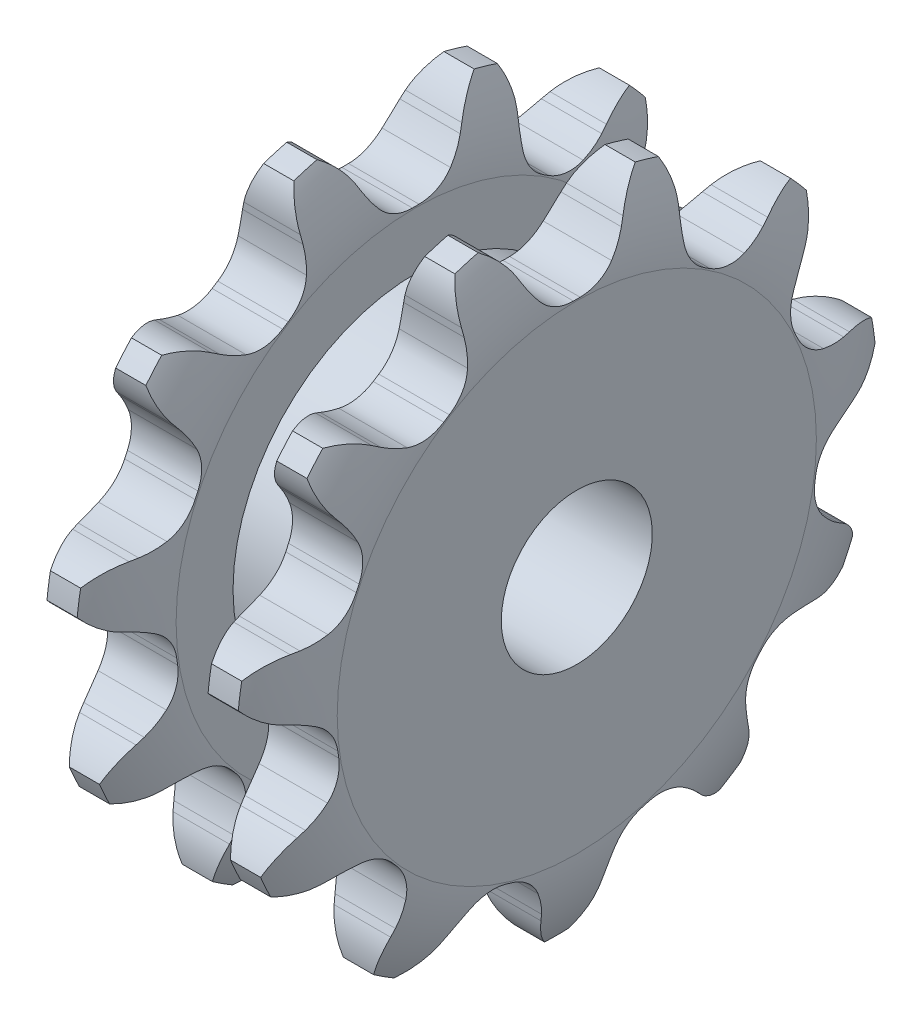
SolidWorks part; units mm, degrees
ref_plane "Plane1" through (0, 0, 0) normal (0, 0, 1) x (1, 0, 0)
ref_plane "Plane2" through (0, 0, 0) normal (0, 1, 0) x (1, 0, 0)
ref_plane "Plane3" through (0, 0, 0) normal (1, 0, 0) x (0, 0, -1)
other "Configuration Table"
sketch "Clipboard" plane through (0, 0, 0) normal (0, 1, 0) x (1, 0, 0)
  line L0 (0, 0) -> (6.2333, -1.2116)
  line L1 (-15, 0) -> (100, 0) construction
  line L2 (0, 0) -> (-0.5301, 0.5991)
  line L3 (0, 0) -> (-2.9891, 1.1425)
  line L4 (0, 0) -> (3.043, 0.5915)
  line L5 (0, 0) -> (-89.0105, -33.1983)
  line L6 (0, 0) -> (-7.6265, -5.1456)
  line L7 (-0.5301, 0.5991) -> (92.0355, 21.9696)
  line L8 (-76.2, 38.1) -> (-75.2, 38.1)
  line L9 (-73.2358, 39.4872) -> (-73.0836, 39.4947)
  line L10 (-73.0533, 76.1892) -> (-66.6533, 76.1892)
  circle A0 centre (0, 0) radius 1.651
  circle A1 centre (0, 0) radius 4
  circle A2 centre (0, 0) radius 4
sketch "BasProSke" plane through (0, 0, 0) normal (0, 1, 0) x (1, 0, 0)
  line L0 (-10, 0) -> (60, 0) construction
  line L1 (0, 0) -> (0, 9.5181)
  line L2 (0, 0) -> (9.2, 0)
  line L3 (9.2, 0) -> (9.2, 9.5181)
  line L4 (8.4, 12.7181) -> (0.8, 12.7181)
  arc A0 (0, 9.5181) -> (0.8, 12.7181) centre (6.8, 9.5181) cw
  arc A1 (9.2, 9.5181) -> (8.4, 12.7181) centre (2.4, 9.5181) ccw
revolve "Base-Revolve" add sketch "BasProSke" angle 360 about L0
sketch "GrvSke" plane through (0, 0, 0) normal (0, 1, 0) x (1, 0, 0)
  line L0 (2.8, 9.5181) -> (2.8, 7.2571)
  line L1 (2.8, 7.2571) -> (6.4, 7.2571)
  line L2 (6.4, 7.2571) -> (6.4, 9.5181)
  line L3 (2, 12.7181) -> (7.2, 12.7181)
  line L4 (4.6, 0) -> (4.6, 52.07) construction
  line L5 (-10, 0) -> (60, 0) construction
  line L6 (0, 0) -> (35.56, 0) construction
  arc A0 (6.4, 9.5181) -> (7.2, 12.7181) centre (13.2, 9.5181) cw
  arc A1 (2.8, 9.5181) -> (2, 12.7181) centre (-4, 9.5181) ccw
revolve "Groove" cut sketch "GrvSke" angle 360 about L6
pattern_linear "Grooves" [suppressed]
sketch "TooCutSke" plane through (0, 0, 0) normal (1, 0, 0) x (0, 0, -1)
  line L0 (1.9692, 10.9762) -> (2.1109, 11.2478)
  line L1 (0, 0) -> (0, 107) construction
  line L2 (0.2483, 11.2688) -> (-2.0258, 11.2688) construction
  line L4 (0.1322, 12.3974) -> (0.1322, 8.6148) construction
  line L5 (0.1322, 9.5714) -> (-0.1322, 9.5714)
  line L6 (-1.9692, 10.9762) -> (-2.1109, 11.2478)
  arc A0 (1.4237, 10.1675) -> (1.9692, 10.9762) centre (-1.8779, 12.9828) ccw
  arc A1 (1.4237, 10.1675) -> (0.1322, 9.5714) centre (0.1322, 11.2688) cw
  arc A2 (2.1109, 11.2478) -> (4.5677, 12.7373) centre (4.5677, 9.9664) cw
  arc A3 (-0.1322, 9.5714) -> (-1.4237, 10.1675) centre (-0.1322, 11.2688) cw
  arc A4 (-1.4237, 10.1675) -> (-1.9692, 10.9762) centre (1.8779, 12.9828) cw
  arc A5 (-2.1109, 11.2478) -> (-4.5677, 12.7373) centre (-4.5677, 9.9664) ccw
  arc A6 (4.5677, 12.7373) -> (-4.5677, 12.7373) centre (0, 0) ccw
extrude "ToothCut" cut sketch "TooCutSke" along normal through all
pattern_circular "TeethCuts" count 11 every 32.727 about axis through (-10, 0, 0) along (1, 0, 0) of "ToothCut"
sketch "HubNeaOneSke" plane through (0, 0, 0) normal (-1, 0, 0) x (0, 0, 1)
  circle A0 centre (0, 0) radius 4
extrude "HubNearOne" [suppressed] add sketch "HubNeaOneSke" along normal blind 85.8005
sketch "HubNeaBotSke" plane through (0, 0, 0) normal (-1, 0, 0) x (0, 0, 1)
  circle A0 centre (0, 0) radius 4
extrude "HubNearBoth" [suppressed] add sketch "HubNeaBotSke" along normal blind 42.9002
ref_plane "FarPln" through (9.2, 0, 0) normal (1, 0, 0) x (0, 0, -1)
sketch "HubFarSke" plane through (9.2, 0, 0) normal (1, 0, 0) x (0, 0, -1)
  circle A0 centre (0, 0) radius 4
extrude "HubFar" [suppressed] add sketch "HubFarSke" along normal blind 42.9002
sketch "BorSke" plane through (0, 0, 0) normal (1, 0, 0) x (0, 0, -1)
  circle A0 centre (0, 0) radius 3
extrude "Bore" cut sketch "BorSke" along normal mid plane 190.001
sketch "KeySke" plane through (0, 0, 0) normal (1, 0, 0) x (0, 0, -1)
  line L0 (-1, 0) -> (-1, 4)
  line L1 (-1, 4) -> (1, 4)
  line L2 (1, 4) -> (1, 0)
  line L3 (0, 0) -> (0, 34) construction
  line L4 (-1, 0) -> (1, 0)
extrude "Keyway" [suppressed] cut sketch "KeySke" along normal mid plane 190.001
pattern_circular "Keyway2" [suppressed] count 2 every 90 about axis through (-10, 0, 0) along (1, 0, 0)
equation "' \"Pitch@Clipboard\" = 6.35"
equation "' \"Num_strands@Clipboard\" = 2"
equation "' \"Num_teeth@Clipboard\" = 11"
equation "' \"Hub_dia@Clipboard\" = 8"
equation "' \"Overall_len@Clipboard\" = 95"
equation "' \"Diameter@BorSke\" = 6"
equation "' \"T_dim@Clipboard\" = 1"
equation "' \"Width@KeySke\" = 2"
equation "' \"Dr@Clipboard\" = 3.302"
equation "' \"Face_width@Clipboard\" = 2.8"
equation "' \"Chamfer_dep@Clipboard\" = 3.2"
equation "' \"Chamfer_wid@Clipboard\" = 0.8"
equation "' \"Transv_pitch@Clipboard\" = 6.4"
equation "' \"Show_teeth@Clipboard\" = 11"
equation "\"Num_teeth@Clipboard\" = int( \"Num_teeth@Clipboard\" )"
equation "\"Num_teeth@Clipboard\" = ((sgn( \"Num_teeth@Clipboard\" - 5.0)+1)*( \"Num_teeth@Clipboard\" - 5.0))/2 +5.0"
equation "\"Num_teeth@Clipboard\" = ((sgn( \"Num_teeth@Clipboard\" - 200.0)-1)*( \"Num_teeth@Clipboard\" - 200.0))/-2 +200.0"
equation "\"MHD@Clipboard\" = \"Pitch@Clipboard\" * (1.0 / tan(3.14159265 / \"Num_teeth@Clipboard\" ) - 1.0) - 0.762"
equation "\"Thickness@Clipboard\"  = \"Face_width@Clipboard\" + (\"Num_strands@Clipboard\" - 1) * \"Transv_pitch@Clipboard\""
equation "\"OAL@Clipboard\" = \"Thickness@Clipboard\""
equation "\"MHD@Clipboard\" = ((sgn( \"MHD@Clipboard\" - \"Hub_dia@Clipboard\" )-1)*( \"MHD@Clipboard\" - \"Hub_dia@Clipboard\" ))/-2+ \"Hub_dia@Clipboard\""
equation "\"OAL@Clipboard\" = ((sgn( \"OAL@Clipboard\" - \"Overall_len@Clipboard\" )+1)*( \"OAL@Clipboard\" - \"Overall_len@Clipboard\" ))/2 + \"Overall_len@Clipboard\" + 0.0005"
equation "\"Num_teeth@TeethCuts\" = int( \"Show_teeth@Clipboard\" ) + 1"
equation "\"Num_teeth@TeethCuts\" = ((sgn( \"Num_teeth@TeethCuts\" - \"Num_teeth@Clipboard\" )-1)*( \"Num_teeth@TeethCuts\" - \"Num_teeth@Clipboard\" ))/-2+ \"Num_teeth@Clipboard\""
equation "\"Num_teeth@TeethCuts\" = ((sgn( \"Num_teeth@TeethCuts\" - 2.0)+1)*( \"Num_teeth@TeethCuts\" - 2.0))/2 +2.0"
equation "\"Angle@TeethCuts\" = 360.0 / \"Num_teeth@Clipboard\""
equation "\"Pitch_radius@TooCutSke\" = ( \"Pitch@Clipboard\" / 2.0) / sin(3.14159265 / \"Num_teeth@Clipboard\" )  'ma"
equation "\"Half_U@TooCutSke\" = 0.5 * (0.07 * (\"Pitch@Clipboard\" - \"Dr@Clipboard\") + 0.051)"
equation "\"R@TooCutSke\"  = \"Dr@Clipboard\" * 0.5025 + 0.0381"
equation "\"A@TooCutSke\" = 35.0 + (60.0 / \"Num_teeth@Clipboard\")"
equation "\"E@TooCutSke\"  = \"Dr@Clipboard\" * 1.3025 + 0.0381"
equation "\"B@TooCutSke\"  = 18.0 - (56.0 / \"Num_teeth@Clipboard\" )"
equation "\"W@TooCutSke\" = 1.4 * \"Dr@Clipboard\" * cos(3.14159265 / \"Num_teeth@Clipboard\" ) + \"Half_U@TooCutSke\""
equation "\"V@TooCutSke\" = 1.4 * \"Dr@Clipboard\" * sin(3.14159265 / \"Num_teeth@Clipboard\" )"
equation "\"Diameter@BasProSke\" = 2.0 * ( (0.3 * \"Pitch@Clipboard\" ) +  \"Pitch@Clipboard\" / 2.0 / tan(3.14159265 / \"Num_teeth@Clipboard\" ))"
equation "\"Thickness@BasProSke\"  = \"Thickness@Clipboard\""
equation "\"G1@BasProSke\" =  \"Chamfer_wid@Clipboard\""
equation "\"G2@BasProSke\" =  \"Chamfer_wid@Clipboard\""
equation "\"H1@BasProSke\" =  \"Chamfer_dep@Clipboard\""
equation "\"H2@BasProSke\" =  \"Chamfer_dep@Clipboard\""
equation "\"Diameter@GrvSke\" = \"Diameter@BasProSke\""
equation "\"G1@GrvSke\" = \"Chamfer_wid@Clipboard\""
equation "\"H1@GrvSke\" = \"Chamfer_dep@Clipboard\""
equation "\"Grv_diam@GrvSke\" =  \"Pitch@Clipboard\" * (1.0 / tan(3.14159265 / \"Num_teeth@Clipboard\" ) - 1.0) - 0.762"
equation "\"Grv_width@GrvSke\" =  \"Transv_pitch@Clipboard\" - \"Face_width@Clipboard\""
equation "\"Offset@GrvSke\" = \"Grv_width@GrvSke\" / 2.0 + \"Face_width@Clipboard\""
equation "\"Offset@Grooves\" = \"Transv_pitch@Clipboard\""
equation "\"Num_grvs@Grooves\" = \"Num_strands@Clipboard\""
equation "\"Num_grvs@Grooves\" = \"Num_grvs@Grooves\" - 1 * sgn( \"Num_grvs@Grooves\" -1)"
equation "\"Diameter@HubNeaOneSke\" = \"MHD@Clipboard\""
equation "\"Length@HubNearOne\" = \"OAL@Clipboard\" - \"Thickness@BasProSke\""
equation "\"Diameter@HubNeaBotSke\" = \"MHD@Clipboard\""
equation "\"Length@HubNearBoth\" = ( \"OAL@Clipboard\" - \"Thickness@BasProSke\" ) / 2.0"
equation "\"Thickness@FarPln\" = \"Thickness@BasProSke\""
equation "\"Diameter@HubFarSke\" = \"MHD@Clipboard\""
equation "\"Length@HubFar\" = ( \"OAL@Clipboard\" - \"Thickness@BasProSke\" ) / 2.0"
equation "\"D1@Bore\" = \"OAL@Clipboard\" * 2.0"
equation "\"D1@Keyway\" = \"OAL@Clipboard\" * 2.0"
equation "\"Offset@KeySke\" = \"T_dim@Clipboard\" + \"Diameter@BorSke\" / 2.0"
